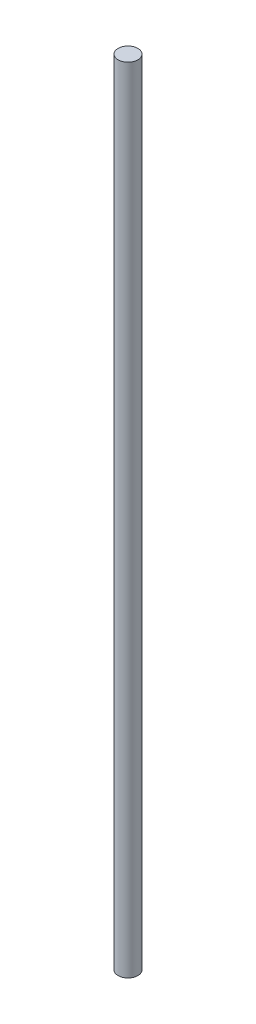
SolidWorks part; units mm, degrees
ref_plane "Front" through (0, 0, 0) normal (0, 0, 1) x (1, 0, 0)
ref_plane "Top" through (0, 0, 0) normal (0, 1, 0) x (1, 0, 0)
ref_plane "Right" through (0, 0, 0) normal (1, 0, 0) x (0, 0, -1)
sketch "Sketch1" plane through (0, 0, 0) normal (0, 0, 1) x (1, 0, 0)
  line L0 (0, 0) -> (0, 40)
  line L1 (0, 40) -> (0.5, 40)
  line L2 (0.5, 40) -> (0.5, 0)
  line L3 (0.5, 0) -> (0, 0)
  line L4 (0, 55.2635) -> (0, -13.4493) construction
  dimension "D1" = 40
  dimension "D2" = 0.5
revolve "Revolve1" add sketch "Sketch1" angle 360 about L4
